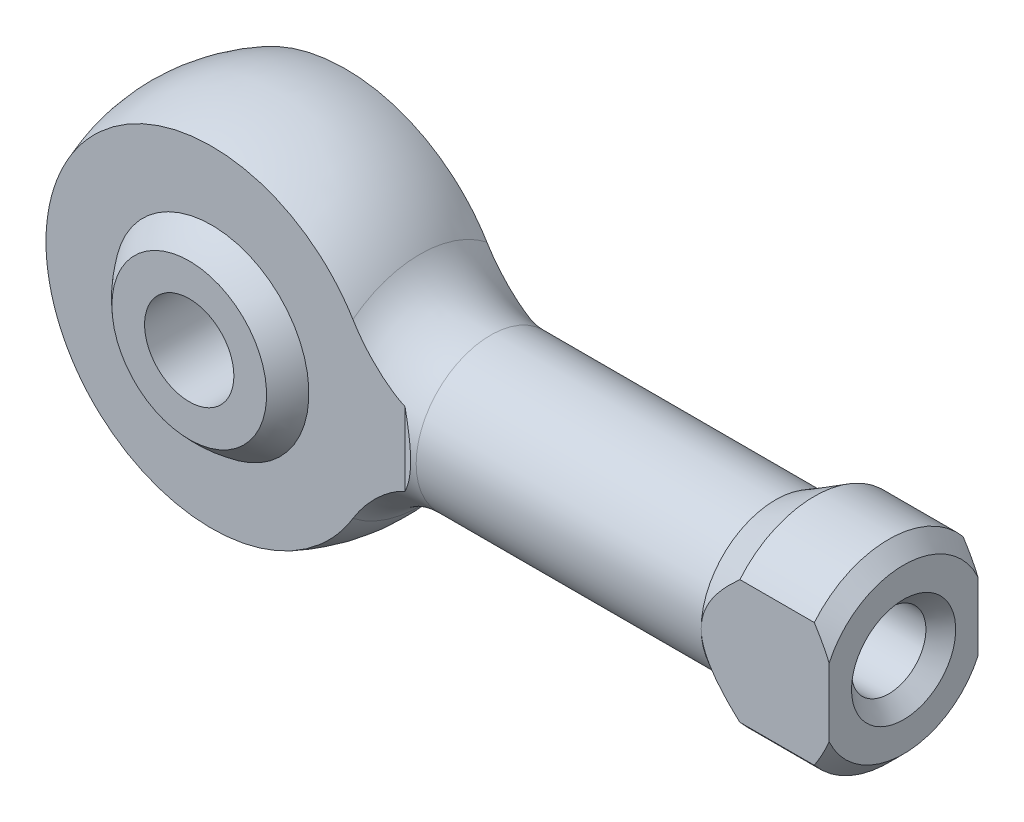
SolidWorks part; units mm, degrees
ref_plane "前视" through (0, 0, 0) normal (0, 0, 1) x (1, 0, 0)
ref_plane "上视" through (0, 0, 0) normal (0, 1, 0) x (1, 0, 0)
ref_plane "右视" through (0, 0, 0) normal (1, 0, 0) x (0, 0, -1)
sketch "草图1" plane through (0, 0, 0) normal (0, 0, 1) x (1, 0, 0)
  line L0 (0, 0) -> (60, 0) construction
  line L1 (7.1239, 2.5) -> (16.701, 2.5)
  line L2 (16.701, 2.5) -> (18, 3.25)
  line L3 (18, 3.25) -> (21, 3.25)
  line L4 (21, 3.25) -> (21, 1.25)
  line L5 (21, 1.25) -> (13, 1.25)
  line L6 (13, 1.25) -> (12.2783, 0)
  line L7 (12.2783, 0) -> (-6, 0)
  arc A0 (4.7493, 3.6667) -> (-6, 0) centre (0, 0) ccw
  arc A1 (4.7493, 3.6667) -> (7.1239, 2.5) centre (7.1239, 5.5) ccw
  dimension "D1" = 6
  dimension "D10" = 3
  dimension "D2" = 6.5
  dimension "D3" = 5
  dimension "D4" = 2.5
  dimension "D5" = 60
  dimension "D6" = 8
  dimension "D7" = 3
  dimension "D8" = 30
  dimension "D9" = 21
revolve "旋转1" add sketch "草图1" angle 360 about L0
chamfer "倒角1" distance 0.5 angle 45 2 edges at (21, 0, 1.25) (21, 0, 3.25)
sketch "草图2" plane through (0, 0, 0) normal (0, 1, 0) x (1, 0, 0)
  line L0 (-7.2099, 0) -> (21, 0) construction
  line L1 (21, -2.75) -> (21, 2.75) construction
  line L2 (-6.839, 2.25) -> (6.5, 2.25)
  line L3 (6.5, 2.25) -> (6.933, 2.5)
  line L4 (16.701, 2.5) -> (7.1239, 2.5) construction
  line L5 (6.933, 2.5) -> (6.933, 8.307)
  line L6 (6.933, 8.307) -> (-7.2099, 8.307)
  line L7 (-7.2099, 8.307) -> (-6.839, 2.25)
  line L8 (-7.2099, -8.307) -> (-6.839, -2.25)
  line L9 (6.933, -8.307) -> (-7.2099, -8.307)
  line L10 (6.933, -2.5) -> (6.933, -8.307)
  line L11 (6.5, -2.25) -> (6.933, -2.5)
  line L12 (-6.839, -2.25) -> (6.5, -2.25)
  line L13 (21.8723, -6.4809) -> (21.8723, -2.5)
  line L14 (13.6958, 6.4809) -> (21.8723, 6.4809)
  line L15 (13.6958, 6.4809) -> (13.6958, 2.5)
  line L16 (13.6958, 2.5) -> (21.8723, 2.5)
  line L17 (21.8723, 6.4809) -> (21.8723, 2.5)
  line L18 (13.6958, -2.5) -> (21.8723, -2.5)
  line L19 (13.6958, -6.4809) -> (13.6958, -2.5)
  line L20 (13.6958, -6.4809) -> (21.8723, -6.4809)
  dimension "D1" = 4.5
  dimension "D2" = 30
  dimension "D3" = 6.5
extrude "切除-拉伸1" cut sketch "草图2" against normal mid plane 40
sketch "草图3" plane through (0, 0, 0) normal (0, 0, 1) x (1, 0, 0)
  line L0 (0, 0) -> (23.8477, 0) construction
  line L1 (-3.969, 0) -> (3.969, 0)
  arc A0 (3.969, 0) -> (-3.969, 0) centre (0, 0) ccw
  dimension "D1" = 7.938
revolve "旋转2" add sketch "草图3" angle 360 about L0
sketch "草图4" plane through (0, 0, 0) normal (0, 1, 0) x (1, 0, 0)
  line L0 (0, 0) -> (-7.8279, 0) construction
  line L1 (4.2552, -6.492) -> (4.2552, -3)
  line L2 (-5.8501, 6.492) -> (4.2552, 6.492)
  line L3 (-5.8501, 6.492) -> (-5.8501, 3)
  line L4 (-5.8501, 3) -> (4.2552, 3)
  line L5 (4.2552, 6.492) -> (4.2552, 3)
  line L6 (-5.8501, -3) -> (4.2552, -3)
  line L7 (-5.8501, -6.492) -> (-5.8501, -3)
  line L8 (-5.8501, -6.492) -> (4.2552, -6.492)
  dimension "D1" = 6
extrude "切除-拉伸2" cut sketch "草图4" against normal mid plane 40
sketch "草图5" plane through (0, 0, 3) normal (0, 0, 1) x (1, 0, 0)
  circle A0 centre (0, 0) radius 1.5
  point P2 (0, 0)
  dimension "D1" = 3
extrude "切除-拉伸3" cut sketch "草图5" against normal mid plane 60
